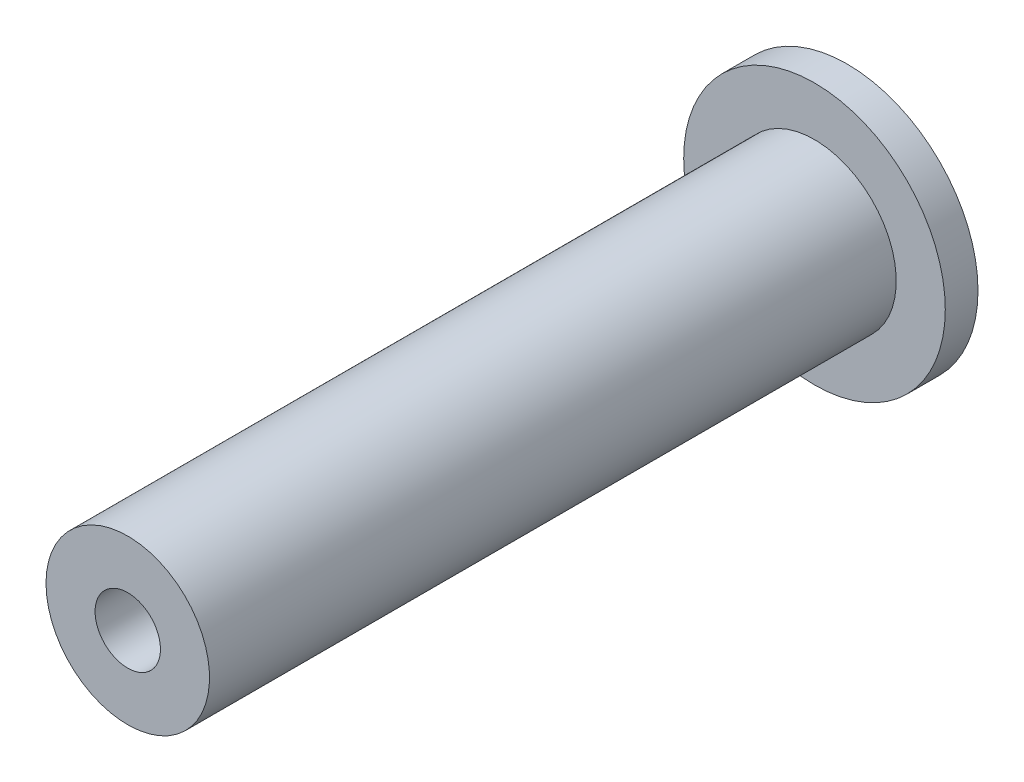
SolidWorks part; units mm, degrees
ref_plane "前视基准面" through (0, 0, 0) normal (0, 0, 1) x (1, 0, 0)
ref_plane "上视基准面" through (0, 0, 0) normal (0, 1, 0) x (1, 0, 0)
ref_plane "右视基准面" through (0, 0, 0) normal (1, 0, 0) x (0, 0, -1)
sketch "草图1" plane through (0, 0, 0) normal (0, 0, 1) x (1, 0, 0)
  circle A0 centre (0, 0) radius 2
  dimension "D1" = 4
extrude "凸台-拉伸1" add sketch "草图1" along normal blind 0.5
sketch "草图2" plane through (0, 0, 0.5) normal (0, 0, 1) x (1, 0, 0)
  circle A0 centre (0, 0) radius 1.25
  dimension "D1" = 2.5
extrude "凸台-拉伸2" add sketch "草图2" along normal blind 10.5
sketch "草图3" plane through (0, 0, 11) normal (0, 0, 1) x (1, 0, 0)
  circle A0 centre (0, 0) radius 0.5
  dimension "D1" = 1
extrude "切除-拉伸1" cut sketch "草图3" against normal blind 2
